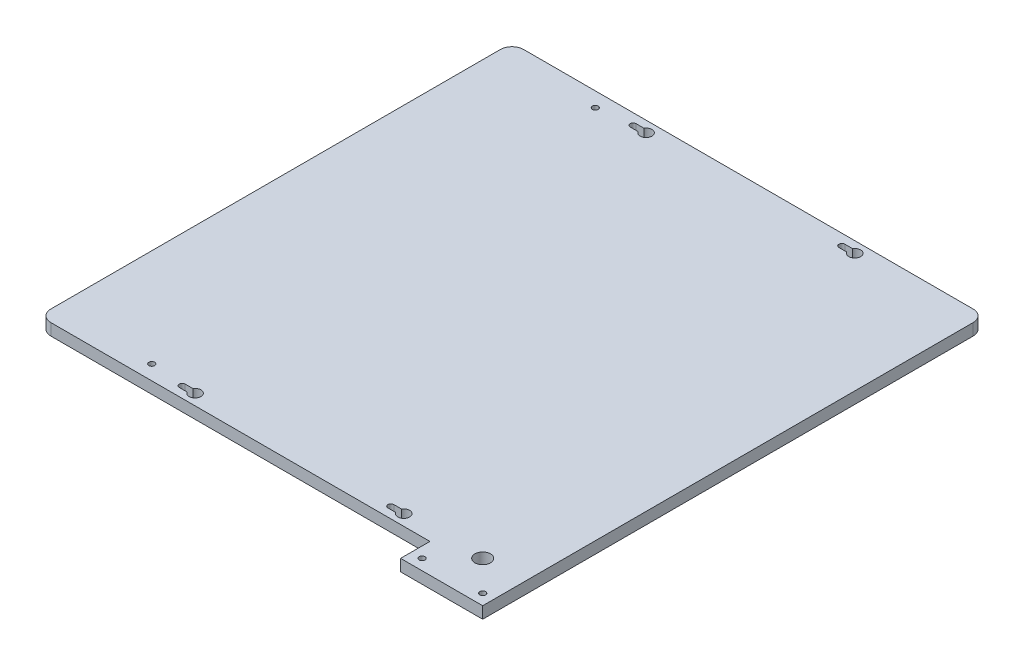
SolidWorks part; units mm, degrees
ref_plane "Front" through (0, 0, 0) normal (0, 0, 1) x (1, 0, 0)
ref_plane "Top" through (0, 0, 0) normal (0, 1, 0) x (1, 0, 0)
ref_plane "Right" through (0, 0, 0) normal (1, 0, 0) x (0, 0, -1)
ref_plane "Plane1" through (0, 3, 0) normal (0, 1, 0) x (1, 0, 0)
sketch "Sketch1" plane through (0, 3, 0) normal (0, 1, 0) x (1, 0, 0)
  line L0 (-121, -121) -> (121, -121)
  line L1 (121, -121) -> (121, 121)
  line L2 (121, 121) -> (-121, 121)
  line L3 (-121, 121) -> (-121, -121)
  line L5 (121, -94) -> (79, -94)
  line L6 (121, -94) -> (121, -136)
  line L7 (121, -136) -> (79, -136)
  line L8 (79, -94) -> (79, -136)
  circle A0 centre (100, -115) radius 4
  circle A1 centre (84.5, -130.5) radius 1.5
  circle A2 centre (115.5, -130.5) radius 1.5
  circle A3 centre (-70.85, -113.5) radius 1.5
  circle A4 centre (-70.85, 113.5) radius 1.5
  dimension "D9" = 8
  dimension "D10" = 3
  dimension "D11" = 3
  dimension "D17" = 3
  dimension "D18" = 7.5
  dimension "D19" = 3
  dimension "D1" = 121
  dimension "D2" = 121
  dimension "D3" = 242
  dimension "D4" = 121
  dimension "D5" = 42
  dimension "D6" = 42
  dimension "D7" = 21
  dimension "D8" = 21
  dimension "D12" = 31
  dimension "D13" = 5.5
  dimension "D14" = 5.5
  dimension "D15" = 15
  dimension "D16" = 50.15
  dimension "D20" = 7.5
  dimension "D21" = 50.15
extrude "Boss-Extrude1" add sketch "Sketch1" against normal blind 6 contours L0 L8 L7 L6 A2 A1 | L5 L8 L0 L1 A0 | L8 L5 L1 L2 L3 L0
sketch "Sketch2" plane through (0, -3, 0) normal (0, 1, 0) x (-1, 0, 0)
  line L0 (-57.4019, -116.9) -> (-53.4, -116.9)
  line L1 (-53.4, -113.9) -> (-57.4019, -113.9)
  arc A0 (-57.4019, -113.9) -> (-57.4019, -116.9) centre (-60, -115.4) cw
  arc A1 (-53.4, -116.9) -> (-53.4, -113.9) centre (-53.4, -115.4) ccw
extrude "Cut-Extrude1" cut sketch "Sketch2" along normal through all
sketch "Sketch3" plane through (0, -3, 0) normal (0, 1, 0) x (-1, 0, 0)
  line L0 (49.3981, -116.9) -> (53.4, -116.9)
  line L1 (53.4, -113.9) -> (49.3981, -113.9)
  arc A0 (49.3981, -113.9) -> (49.3981, -116.9) centre (46.8, -115.4) cw
  arc A1 (53.4, -116.9) -> (53.4, -113.9) centre (53.4, -115.4) ccw
extrude "Cut-Extrude2" cut sketch "Sketch3" along normal through all
sketch "Sketch4" plane through (0, -3, 0) normal (0, 1, 0) x (-1, 0, 0)
  line L0 (-57.4019, 113.9) -> (-53.4, 113.9)
  line L1 (-53.4, 116.9) -> (-57.4019, 116.9)
  arc A0 (-57.4019, 116.9) -> (-57.4019, 113.9) centre (-60, 115.4) cw
  arc A1 (-53.4, 113.9) -> (-53.4, 116.9) centre (-53.4, 115.4) ccw
extrude "Cut-Extrude3" cut sketch "Sketch4" along normal through all
sketch "Sketch5" plane through (0, 3, 0) normal (0, -1, 0) x (1, 0, 0)
  line L0 (-53.4, 113.9) -> (-49.3981, 113.9)
  line L1 (-49.3981, 116.9) -> (-53.4, 116.9)
  arc A0 (-53.4, 116.9) -> (-53.4, 113.9) centre (-53.4, 115.4) ccw
  arc A1 (-49.3981, 113.9) -> (-49.3981, 116.9) centre (-46.8, 115.4) cw
extrude "Cut-Extrude4" cut sketch "Sketch5" along normal through all
ref_plane "Plane2" through (0, 0, -115.4) normal (0, 0, 1) x (1, 0, 0)
sketch "Sketch6" plane through (0, 0, -115.4) normal (0, 0, 1) x (1, 0, 0)
  line L0 (63, 3) -> (60, 3)
  line L1 (60, 3) -> (60, -3)
  line L2 (60, -3) -> (63, -3)
  line L3 (63, -3) -> (63, 3)
  line L4 (60, 3) -> (60, -3) construction
revolve "Cut-Revolve1" cut sketch "Sketch6" angle 360 about L4
sketch "Sketch7" plane through (0, 0, -115.4) normal (0, 0, 1) x (1, 0, 0)
  line L0 (-43.8, 3) -> (-46.8, 3)
  line L1 (-46.8, 3) -> (-46.8, -3)
  line L2 (-46.8, -3) -> (-43.8, -3)
  line L3 (-43.8, -3) -> (-43.8, 3)
  line L4 (-46.8, 3) -> (-46.8, -3) construction
revolve "Cut-Revolve2" cut sketch "Sketch7" angle 360 about L4
ref_plane "Plane3" through (0, 0, 115.4) normal (0, 0, 1) x (1, 0, 0)
sketch "Sketch8" plane through (0, 0, 115.4) normal (0, 0, 1) x (1, 0, 0)
  line L0 (63, 3) -> (60, 3)
  line L1 (60, 3) -> (60, -3)
  line L2 (60, -3) -> (63, -3)
  line L3 (63, -3) -> (63, 3)
  line L4 (60, 3) -> (60, -3) construction
revolve "Cut-Revolve3" cut sketch "Sketch8" angle 360 about L4
sketch "Sketch9" plane through (0, 0, 115.4) normal (0, 0, 1) x (1, 0, 0)
  line L0 (-43.8, 3) -> (-46.8, 3)
  line L1 (-46.8, 3) -> (-46.8, -3)
  line L2 (-46.8, -3) -> (-43.8, -3)
  line L3 (-43.8, -3) -> (-43.8, 3)
  line L4 (-46.8, 3) -> (-46.8, -3) construction
revolve "Cut-Revolve4" cut sketch "Sketch9" angle 360 about L4
fillet "Fillet1" radius 6 3 edges at (-121, 0, 121) (-121, 0, -121) (121, 0, -121)
